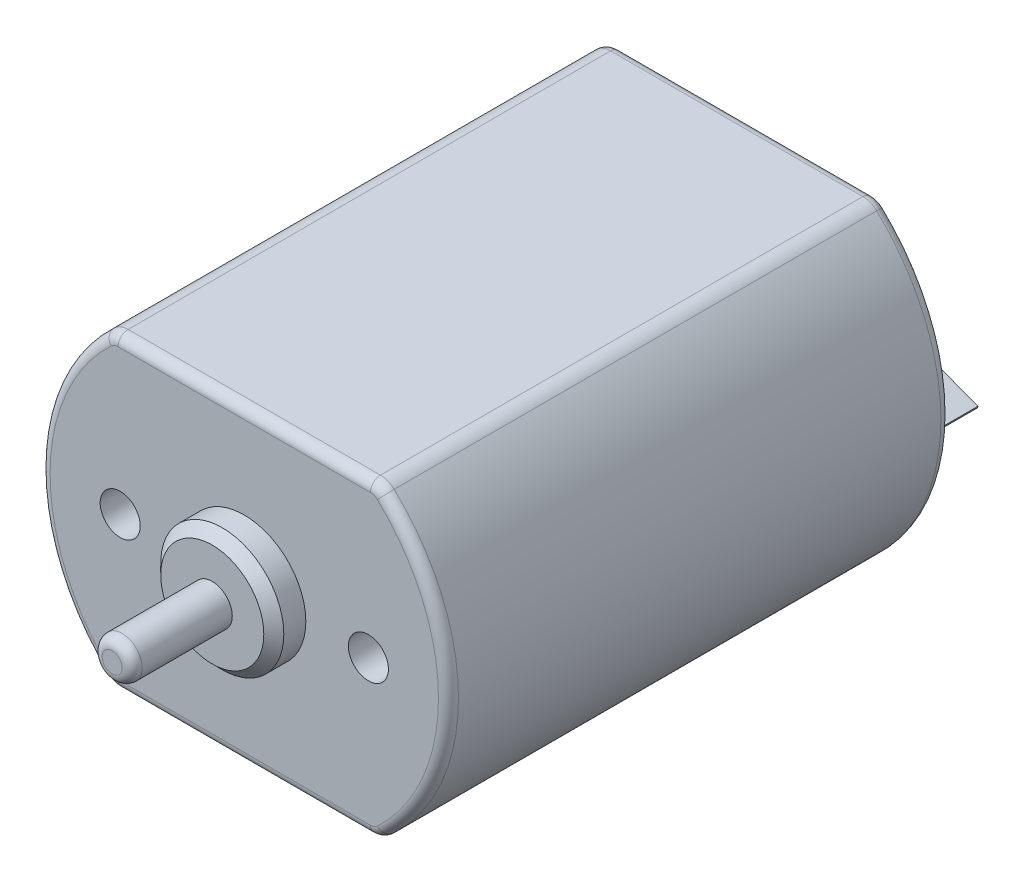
SolidWorks part; units mm, degrees
ref_plane "Front Plane" through (0, 0, 0) normal (0, 0, 1) x (1, 0, 0)
ref_plane "Top Plane" through (0, 0, 0) normal (0, 1, 0) x (1, 0, 0)
ref_plane "Right Plane" through (0, 0, 0) normal (1, 0, 0) x (0, 0, -1)
ref_plane "Plane1" through (0, 0, 12.55) normal (0, 0, 1) x (1, 0, 0)
sketch "Sketch1" plane through (0, 0, 12.55) normal (0, 0, 1) x (1, 0, 0)
  line L0 (-6.6895, -7.7) -> (6.6895, -7.7)
  line L1 (6.6895, 7.7) -> (-6.6895, 7.7)
  arc A0 (-6.6895, 7.7) -> (-6.6895, -7.7) centre (0, 0) ccw
  arc A1 (6.6895, -7.7) -> (6.6895, 7.7) centre (0, 0) ccw
extrude "Boss-Extrude1" add sketch "Sketch1" against normal blind 25.1
sketch "Sketch2" plane through (0, 0, -12.55) normal (0, 0, -1) x (-1, 0, 0)
  line L0 (-8.5192, -2.087) -> (-8.5542, -1.9934)
  line L1 (-8.5542, -1.9934) -> (-6.6808, -1.293)
  line L2 (-6.6808, -1.293) -> (-6.6458, -1.3866)
  line L3 (-6.6458, -1.3866) -> (-8.5192, -2.087)
extrude "Boss-Extrude2" add sketch "Sketch2" along normal blind 3
sketch "Sketch3" plane through (0, 0, -12.55) normal (0, 0, -1) x (-1, 0, 0)
  line L0 (6.6808, 1.293) -> (6.6458, 1.3866)
  line L1 (6.6458, 1.3866) -> (8.5192, 2.087)
  line L2 (8.5192, 2.087) -> (8.5542, 1.9934)
  line L3 (8.5542, 1.9934) -> (6.6808, 1.293)
extrude "Boss-Extrude3" add sketch "Sketch3" along normal blind 3
ref_plane "Plane2" through (0, 0, 0) normal (0, -1, 0) x (1, 0, 0)
sketch "Sketch4" plane through (0, 0, 0) normal (0, -1, 0) x (1, 0, 0)
  line L0 (3.075, -12.55) -> (0, -12.55)
  line L1 (0, -12.55) -> (0, -14.65)
  line L2 (0, -14.65) -> (3.075, -14.65)
  line L3 (3.075, -14.65) -> (3.075, -12.55)
  line L4 (0, -12.55) -> (0, -14.65) construction
revolve "Revolve1" add sketch "Sketch4" angle 360 about L4
sketch "Sketch5" plane through (0, 0, 0) normal (0, 1, 0) x (1, 0, 0)
  line L0 (3.075, -12.55) -> (0, -12.55)
  line L1 (0, -12.55) -> (0, -19.15)
  line L2 (0, -19.15) -> (1, -19.15)
  line L3 (1, -19.15) -> (1, -14.15)
  line L4 (1, -14.15) -> (3.075, -14.15)
  line L5 (3.075, -14.15) -> (3.075, -12.55)
  line L6 (0, -12.55) -> (0, -19.15) construction
revolve "Revolve2" add sketch "Sketch5" angle 360 about L6
hole_wizard "#1 Clearance Hole1" positions "Sketch7" profile "Sketch6" hole size "#1" standard "ANSI Inch"
sketch "Sketch7" plane through (0, 0, 12.55) normal (0, 0, 1) x (1, 0, 0)
  point P0 (6.2, 0)
  point P1 (-6.2, 0)
sketch "Sketch6" plane through (6.2, 0, 12.55) normal (1, 0, 0) x (0, -1, 0)
  line L0 (0, 0) -> (0, 4)
  line L1 (0, 4) -> (1, 4)
  line L2 (1, 4) -> (1, 0)
  line L5 (1, 0) -> (0, 0)
  line L10 (0, 4) -> (-1, 4) construction
  line L11 (0, -6.35) -> (0, 107.95) construction
  dimension "Hole Dia." = 2
  dimension "Hole Depth" = 4
  dimension "Drill Angle" = 180
fillet "Fillet1" radius 1 4 edges at (-6.6895, -7.7, 0) (-6.6895, 7.7, 0) (6.6895, -7.7, 0) (6.6895, 7.7, 0)
chamfer "Chamfer1" distance 0.5 angle 45 2 edges at (-3.075, 0, -14.65) (3.075, 0, 14.15)
fillet "Fillet2" radius 0.5 17 edges at (0, -7.7, -12.55) (6.6734, -7.6296, -12.55) (-6.6734, -7.6296, -12.55) (10.2, 0, -12.55) (-10.2, 0, -12.55) (6.6734, 7.6296, -12.55) (-6.6734, 7.6296, -12.55) (0, 7.7, -12.55) (6.6734, 7.6296, 12.55) (0, 7.7, 12.55) (10.2, 0, 12.55) (-6.6734, 7.6296, 12.55) (6.6734, -7.6296, 12.55) (-10.2, 0, 12.55) (0, -7.7, 12.55) (-6.6734, -7.6296, 12.55) (1, 0, 19.15)
